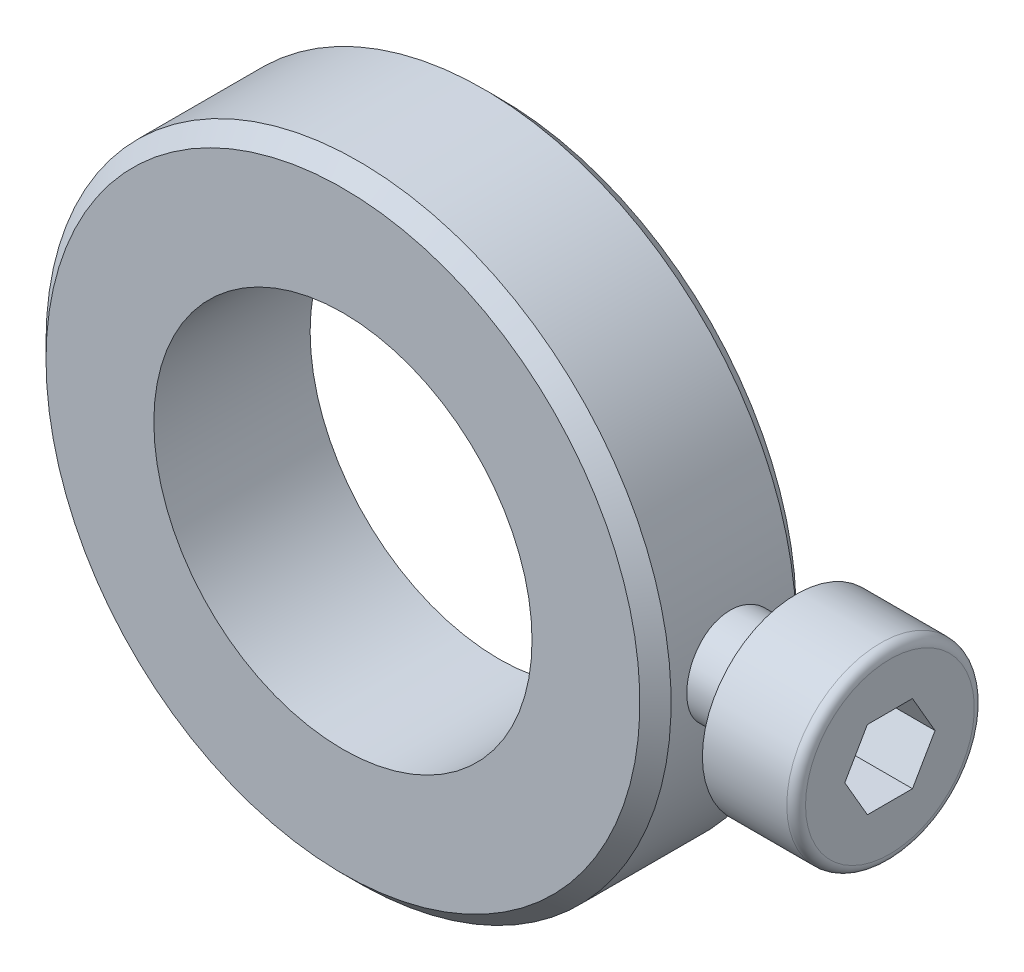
SolidWorks part; units mm, degrees
ref_plane "Plan1" through (0, 0, 0) normal (0, 0, 1) x (1, 0, 0)
ref_plane "Plan2" through (0, 0, 0) normal (0, 1, 0) x (1, 0, 0)
ref_plane "Plan3" through (0, 0, 0) normal (1, 0, 0) x (0, 0, -1)
sketch "Esquisse1" plane through (0, 0, 0) normal (0, 0, 1) x (1, 0, 0)
  circle A0 centre (0, 0) radius 10
extrude "Base-Extrusion" add sketch "Esquisse1" against normal mid plane 5
chamfer "Chanfrein1" distance 0.5 angle 45 2 edges at (-10, 0, 2.5) (-10, 0, -2.5)
sketch "Esquisse2" plane through (0, 0, 2.5) normal (0, 0, 1) x (1, 0, 0)
  circle A0 centre (0, 0) radius 6.05
  circle A1 centre (0, 0) radius 10 construction
  dimension "D1" = 12.1
extrude "Enlèv. mat.-Extru.1" cut sketch "Esquisse2" against normal through all
sketch "Esquisse3" plane through (0, 0, 0) normal (0, 0, 1) x (1, 0, 0)
  line L0 (0, 0) -> (13.5546, 0) construction
  line L1 (8.9691, 1.5) -> (12, 1.5)
  line L2 (12, 1.5) -> (12, 3)
  line L3 (12, 3) -> (14.7, 3)
  line L4 (15, 2.7) -> (15, 0)
  line L5 (8.9691, 1.5) -> (8.9691, 0)
  line L6 (15, 0) -> (8.9691, 0)
  arc A0 (14.7, 3) -> (15, 2.7) centre (14.7, 2.7) cw
  dimension "D1" = 0.3
  dimension "D2" = 3
  dimension "D3" = 3
  dimension "D4" = 12
  dimension "D5" = 6
revolve "Révolution1" add sketch "Esquisse3" angle 360 about L0
sketch "Esquisse4" plane through (15, 0, 0) normal (1, 0, 0) x (0, 0, -1)
  line L1 (0.7228, -1.2494) -> (1.4434, 0.0013)
  line L2 (1.4434, 0.0013) -> (0.7206, 1.2506)
  line L3 (0.7206, 1.2506) -> (-0.7228, 1.2494)
  line L4 (-0.7228, 1.2494) -> (-1.4434, -0.0013)
  line L5 (-1.4434, -0.0013) -> (-0.7206, -1.2506)
  line L6 (-0.7206, -1.2506) -> (0.7228, -1.2494)
  circle A0 centre (0, 0) radius 1.25 construction
  dimension "D1" = 2.5
extrude "Enlèv. mat.-Extru.2" cut sketch "Esquisse4" against normal blind 2
